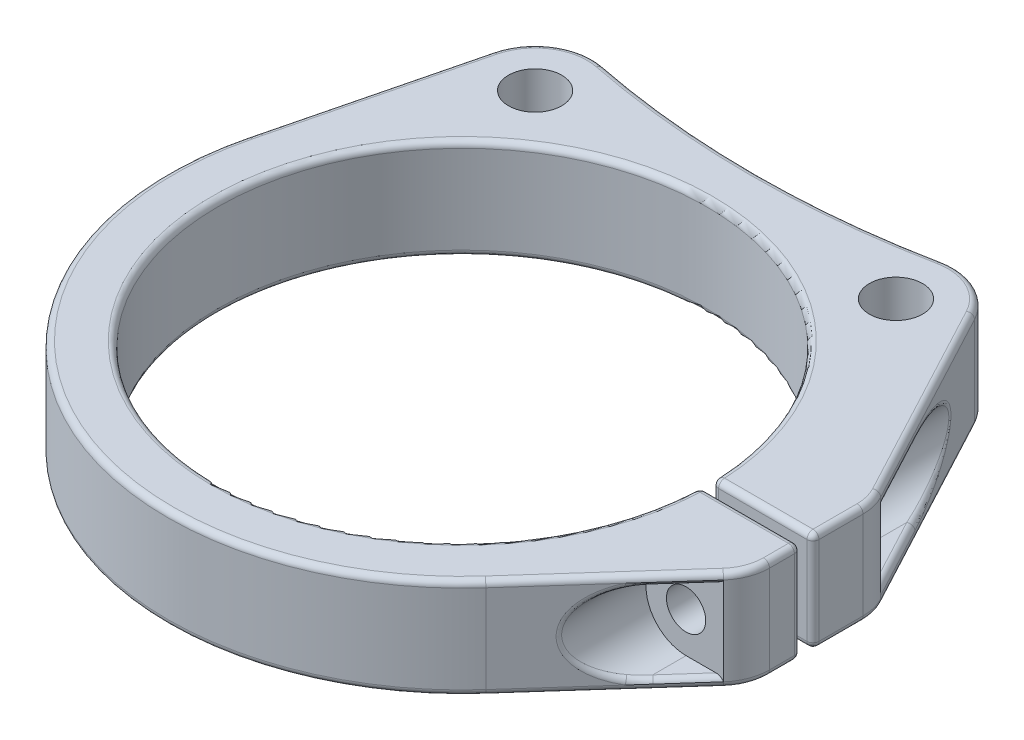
SolidWorks part; units mm, degrees
ref_plane "Front Plane" through (0, 0, 0) normal (0, 0, 1) x (1, 0, 0)
ref_plane "Top Plane" through (0, 0, 0) normal (0, 1, 0) x (1, 0, 0)
ref_plane "Right Plane" through (0, 0, 0) normal (1, 0, 0) x (0, 0, -1)
sketch "Sketch1" plane through (0, 0, 0) normal (0, 1, 0) x (1, 0, 0)
  line L2 (-30.0281, 186.1282) -> (-36.2283, 161.2674)
  line L3 (0, 152.2322) -> (60.3114, 152.2322) construction
  line L4 (43.6778, 153.0259) -> (30.9778, 153.0259)
  line L6 (42.9328, 162.3604) -> (29.3828, 187.8077)
  line L8 (43.6778, 153.0259) -> (43.6778, 159.3759)
  line L10 (42.0644, 143.2815) -> (27.851, 127.3636)
  line L11 (43.6778, 151.4384) -> (43.6778, 147.5109)
  line L12 (43.6778, 151.4384) -> (30.9778, 151.4384)
  arc A0 (30.9778, 153.0259) -> (30.9778, 151.4384) centre (0, 152.2322) ccw
  circle A1 centre (-22.8811, 184.3457) radius 3.3735
  circle A2 centre (22.8811, 184.3457) radius 3.3735
  arc A3 (-36.2283, 161.2674) -> (27.851, 127.3636) centre (0, 152.2322) ccw
  arc A4 (-30.0281, 186.1282) -> (-21.444, 191.5702) centre (-22.8811, 184.3457) cw
  arc A5 (29.3828, 187.8077) -> (21.4441, 191.5702) centre (22.8811, 184.3457) ccw
  arc A6 (31.037, 159.2079) -> (-31.037, 159.2079) centre (0, 152.2322) ccw construction
  circle A7 centre (22.8811, 184.3457) radius 3.3735 construction
  arc A8 (43.6778, 159.3759) -> (42.9328, 162.3604) centre (37.3278, 159.3759) ccw
  arc A9 (42.0644, 143.2815) -> (43.6778, 147.5109) centre (37.3278, 147.5109) ccw
  circle A10 centre (-22.8811, 184.3457) radius 3.3735 construction
  arc A11 (-53.334, 203.5551) -> (41.9668, 198.0598) centre (0.0001, 299.3766) ccw construction
  arc A13 (21.4441, 191.5702) -> (-21.444, 191.5702) centre (0.0001, 299.3766) cw
  point P2 (0, 0)
  point P4 (-18.7922, 190.4726)
  point P6 (0, 258.4327)
  point P7 (0, 280.3943)
  point P8 (20.125, 182.428)
  point P29 (43.6778, 145.0884)
  dimension "D2" = 30.988
  dimension "D3" = 0.7937
  dimension "D1" = 6.35
  dimension "D8" = 12.7
  dimension "D7" = 7.366
  dimension "D9" = 6.35
  dimension "D10" = 6.35
  dimension "D11" = 6.35
extrude "Boss-Extrude1" add sketch "Sketch1" along normal mid plane 12.7
ref_plane "Plane3" through (0, 0, -152.2322) normal (0, 0, 1) x (1, 0, 0)
ref_plane "Plane1" through (0, 0, -190.3322) normal (0, 0, 1) x (1, 0, 0)
hole_wizard "#9 (0.196) Diameter Hole1" positions "Sketch4" profile "Sketch3" hole size "#9" standard "ANSI Inch"
sketch "Sketch4" plane through (0, 0, -190.3322) normal (0, 0, 1) x (1, 0, 0)
  line L1 (43.6778, 6.35) -> (43.6778, -6.35) construction
  point P0 (37.3278, 0)
  point P3 (37.3278, 0)
  dimension "D1" = 6.35
sketch "Sketch3" plane through (37.3278, 0, -190.3322) normal (1, 0, 0) x (0, 1, 0)
  line L0 (0, 0) -> (0, 75.438)
  line L1 (0, 75.438) -> (2.4892, 75.438)
  line L2 (2.4892, 75.438) -> (2.4892, 0)
  line L5 (2.4892, 0) -> (0, 0)
  line L11 (0, -6.35) -> (0, 107.95) construction
  dimension "Thru Hole Dia." = 4.9784
  dimension "Thru Hole Depth" = 75.438
sketch "Sketch6" plane through (0, 0, -190.3322) normal (0, 0, 1) x (1, 0, 0)
  line L0 (37.3278, 4.445) -> (43.6778, 4.445)
  line L2 (37.3278, -4.445) -> (43.6778, -4.445)
  line L3 (43.6778, -4.445) -> (43.6778, 4.445)
  line L4 (43.6778, 6.35) -> (43.6778, -6.35) construction
  arc A0 (37.3278, 4.445) -> (37.3278, -4.445) centre (37.3278, 0) ccw
  circle A1 centre (37.3278, 0) radius 2.4892 construction
  dimension "D1" = 4.445
extrude "Cut-Extrude3" cut sketch "Sketch6" along normal up to vertex
ref_plane "Plane2" through (0, 0, -129.3722) normal (0, 0, 1) x (1, 0, 0)
sketch "Sketch5" plane through (0, 0, -129.3722) normal (0, 0, 1) x (1, 0, 0)
  line L0 (37.3278, 5.08) -> (43.6778, 5.08)
  line L2 (43.6778, 5.08) -> (43.6778, -5.08)
  line L3 (43.6778, -5.08) -> (37.3278, -5.08)
  line L4 (43.6778, 6.35) -> (43.6778, -6.35) construction
  arc A0 (37.3278, -5.08) -> (37.3278, 5.08) centre (37.3278, 0) cw
  circle A3 centre (37.3278, 0) radius 2.4892 construction
  dimension "D1" = 5.08
extrude "Cut-Extrude1" cut sketch "Sketch5" against normal up to vertex
fillet "Fillet1" radius 0.762 32 edges at (43.6778, -6.35, -156.2009) (43.4888, -6.35, -160.914) (36.1578, -6.35, -175.0841) (26.0357, -6.35, -191.002) (-26.825, -6.35, -190.5669) (-33.1282, -6.35, -173.6978) (43.6778, -6.35, -149.4747) (43.2608, -6.35, -145.2475) (34.9577, -6.35, -135.3225) (43.6778, 6.35, -156.2009) (43.4888, 6.35, -160.914) (36.1578, 6.35, -175.0841) (26.0357, 6.35, -191.002) (-26.825, 6.35, -190.5669) (-33.1282, 6.35, -173.6978) (43.6778, 6.35, -149.4747) (43.2608, 6.35, -145.2475) (34.9577, 6.35, -135.3225) (30.9778, 0, -151.4384) (30.9778, 0, -153.0259) (37.3278, -6.35, -151.4384) (37.3278, -6.35, -153.0259) (43.6778, 0, -153.0259) (43.6778, 0, -151.4384) (37.3278, 6.35, -153.0259) (37.3278, 6.35, -151.4384) (-17.4617, -6.35, -119.2289) (-30.988, -6.35, -152.2322) (-30.988, 6.35, -152.2322) (-17.4617, 6.35, -119.2289) (0, -6.35, -189.4581) (0, 6.35, -189.4581)
fillet "Fillet2" radius 0.762 6 edges at (40.1303, -4.445, -167.6236) (40.1303, 4.445, -167.6236) (39.6961, -5.08, -140.6292) (39.6961, 5.08, -140.6292) (32.8828, 0, -181.2346) (32.2478, 0, -132.2877)
